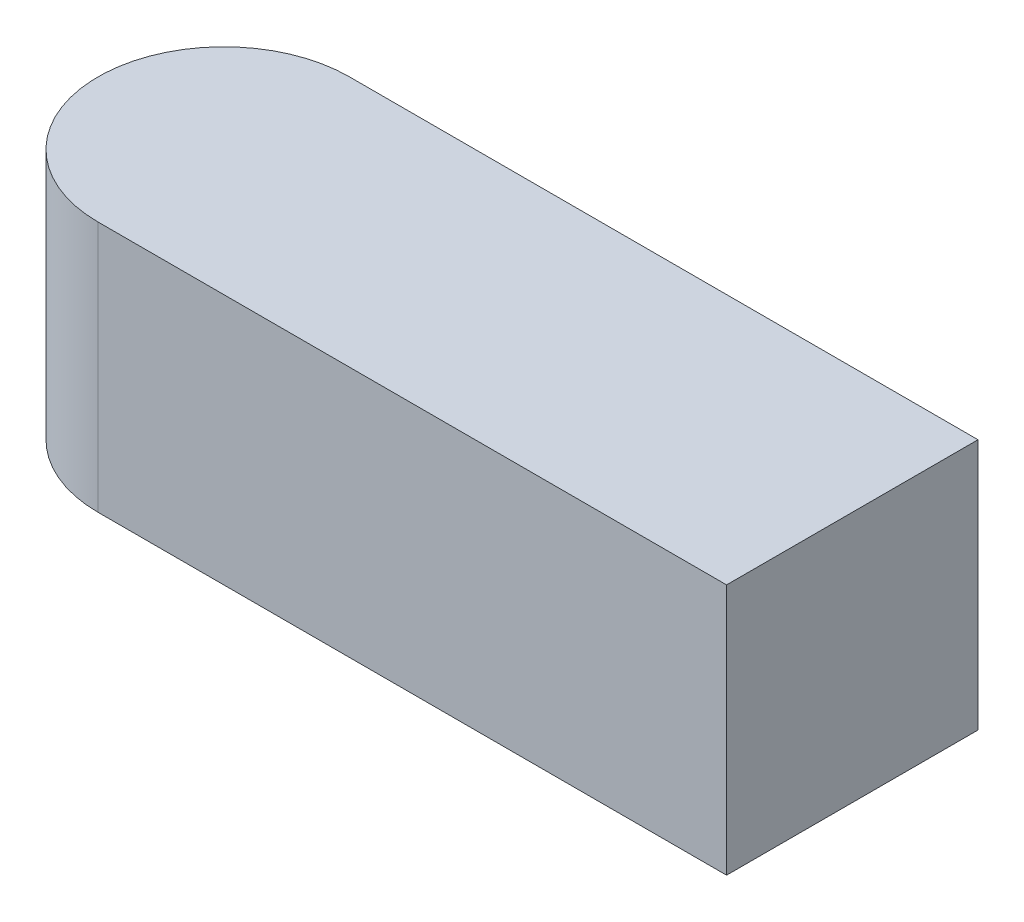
SolidWorks part; units mm, degrees
ref_plane "Face" through (0, 0, 0) normal (0, 0, 1) x (1, 0, 0)
ref_plane "Dessus" through (0, 0, 0) normal (0, 1, 0) x (1, 0, 0)
ref_plane "Droite" through (0, 0, 0) normal (1, 0, 0) x (0, 0, -1)
sketch "Esquisse1" plane through (0, 0, 0) normal (0, 1, 0) x (1, 0, 0)
  line L1 (0, 3) -> (15, 3)
  line L3 (0, -3) -> (15, -3)
  line L4 (15, 3) -> (15, -3)
  arc A0 (0, 3) -> (0, -3) centre (0, 0) ccw
  dimension "D1" = 6
  dimension "D2" = 15
extrude "Base-Extrusion" add sketch "Esquisse1" along normal blind 6
